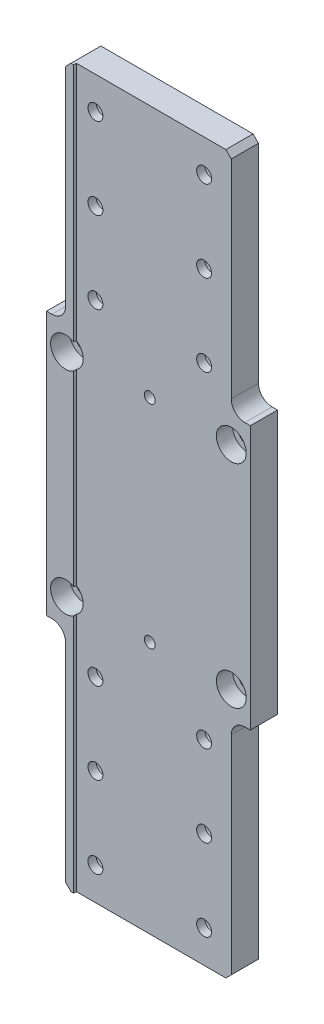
SolidWorks part; units mm, degrees
ref_plane "정면" through (0, 0, 0) normal (0, 0, 1) x (1, 0, 0)
ref_plane "윗면" through (0, 0, 0) normal (0, 1, 0) x (1, 0, 0)
ref_plane "우측면" through (0, 0, 0) normal (1, 0, 0) x (0, 0, -1)
sketch "스케치1" plane through (0, 0, 0) normal (0, 0, 1) x (1, 0, 0)
  line L1 (30, 132) -> (-30, 132)
  line L2 (30, 132) -> (30, -132)
  line L3 (30, -132) -> (-30, -132)
  line L4 (-30, 132) -> (-30, -132)
  line L5 (30, 132) -> (-30, -132) construction
  line L6 (30, -132) -> (-30, 132) construction
  line L7 (-37, 48.5) -> (37, 48.5)
  line L8 (-37, 48.5) -> (-37, -48.5)
  line L9 (-37, -48.5) -> (37, -48.5)
  line L10 (37, 48.5) -> (37, -48.5)
  point P0 (0, 0)
  dimension "D1" = 7
  dimension "D2" = 60
  dimension "D3" = 7
  dimension "D4" = 83.5
  dimension "D5" = 97
  dimension "D6" = 83.5
extrude "보스-돌출1" add sketch "스케치1" along normal blind 11 contours L4 L7 L2 L1 | L4 L9 L2 L7 | L9 L4 L3 L2
sketch "스케치2" plane through (0, 0, 11) normal (0, 0, 1) x (1, 0, 0)
  line L0 (-37, 48.5) -> (-37, -48.5) construction
  line L1 (-27, 132) -> (37, 132)
  line L2 (-27, 132) -> (-27, -132)
  line L3 (-27, -132) -> (37, -132)
  line L4 (37, 132) -> (37, -132)
  line L5 (30, 132) -> (-30, 132) construction
  line L6 (30, -132) -> (-30, -132) construction
  line L7 (37, 48.5) -> (37, -48.5) construction
  dimension "D1" = 10
extrude "컷-돌출1" cut sketch "스케치2" against normal blind 1
hole_wizard "M6 소켓 머리 캡 나사용 카운터보어1" positions "스케치3" profile "스케치4" counterbore size "M6" standard "KS"
sketch "스케치3" plane through (0, 0, 11) normal (0, 0, 1) x (1, 0, 0)
  line L0 (30, 132) -> (-27, 132) construction
  line L1 (0, 163.4922) -> (0, -164.8237) construction
  point P0 (-30, 39)
  point P2 (30, 39)
  point P4 (-30, -39)
  point P6 (30, -39)
  dimension "D1" = 93
  dimension "D2" = 78
  dimension "D3" = 60
  dimension "D4" = 30
sketch "스케치4" plane through (-30, 39, 11) normal (1, 0, 0) x (0, -1, 0)
  line L0 (0, 0) -> (0, 11)
  line L1 (0, 11) -> (3.3, 11)
  line L3 (3.3, 11) -> (3.3, 7)
  line L4 (3.3, 7) -> (5.5, 7)
  line L5 (5.5, 7) -> (5.5, 0)
  line L7 (5.5, 0) -> (0, 0)
  line L11 (0, -6.35) -> (0, 107.95) construction
  dimension "관통 구멍 지름" = 6.6
  dimension "관통 구멍 깊이" = 11
  dimension "카운터보어 지름" = 11
  dimension "카운터보어 깊이" = 7
hole_wizard "M5 소켓 머리 캡 나사용 카운터보어1" positions "스케치5" profile "스케치6" counterbore size "M5" standard "KS"
sketch "스케치5" plane through (0, 0, 0) normal (0, 0, -1) x (-1, 0, 0)
  line L0 (0, 170.8436) -> (0, -172.7731) construction
  line L2 (-30, 132) -> (30, 132) construction
  point P0 (-20, 120)
  point P2 (-20, 90)
  point P4 (20, 90)
  point P6 (-20, 60)
  point P8 (20, 60)
  point P10 (20, 120)
  dimension "D1" = 40
  dimension "D2" = 20
  dimension "D3" = 12
  dimension "D4" = 30
  dimension "D5" = 30
sketch "스케치6" plane through (20, 120, 0) normal (1, 0, 0) x (0, 1, 0)
  line L0 (0, 0) -> (0, 11)
  line L1 (0, 11) -> (2.75, 11)
  line L3 (2.75, 11) -> (2.75, 7)
  line L4 (2.75, 7) -> (4.75, 7)
  line L5 (4.75, 7) -> (4.75, 0)
  line L7 (4.75, 0) -> (0, 0)
  line L11 (0, -6.35) -> (0, 107.95) construction
  dimension "관통 구멍 지름" = 5.5
  dimension "관통 구멍 깊이" = 11
  dimension "카운터보어 지름" = 9.5
  dimension "카운터보어 깊이" = 7
pattern_linear "선형 패턴1" count 2 spacing 180 along (0, -1, 0) of "M5 소켓 머리 캡 나사용 카운터보어1"
hole_wizard "Ø4.0mm 맞춤핀 구멍1" positions "스케치7" profile "스케치8" hole size "Ø4.0" standard "ISO"
sketch "스케치7" plane through (0, 0, 0) normal (0, 0, -1) x (-1, 0, 0)
  line L0 (0, 164.2013) -> (0, -156.9579) construction
  line L2 (-30, 132) -> (30, 132) construction
  point P0 (0, 39)
  point P2 (0, -39)
  dimension "D1" = 93
  dimension "D2" = 78
sketch "스케치8" plane through (0, 39, 0) normal (1, 0, 0) x (0, 1, 0)
  line L0 (0, 0) -> (0, 11)
  line L1 (0, 11) -> (2, 11)
  line L2 (2, 11) -> (2, 0)
  line L5 (2, 0) -> (0, 0)
  line L11 (0, -6.35) -> (0, 107.95) construction
  dimension "관통 구멍 지름" = 4
  dimension "관통 구멍 깊이" = 11
fillet "필렛1" radius 5 4 edges at (30, -48.5, 5) (-30, -48.5, 5.5) (-30, 48.5, 5.5) (30, 48.5, 5)
chamfer "모따기1" distance 2 angle 45 4 edges at (30, -132, 5) (-30, -132, 5.5) (-30, 132, 5.5) (30, 132, 5)
